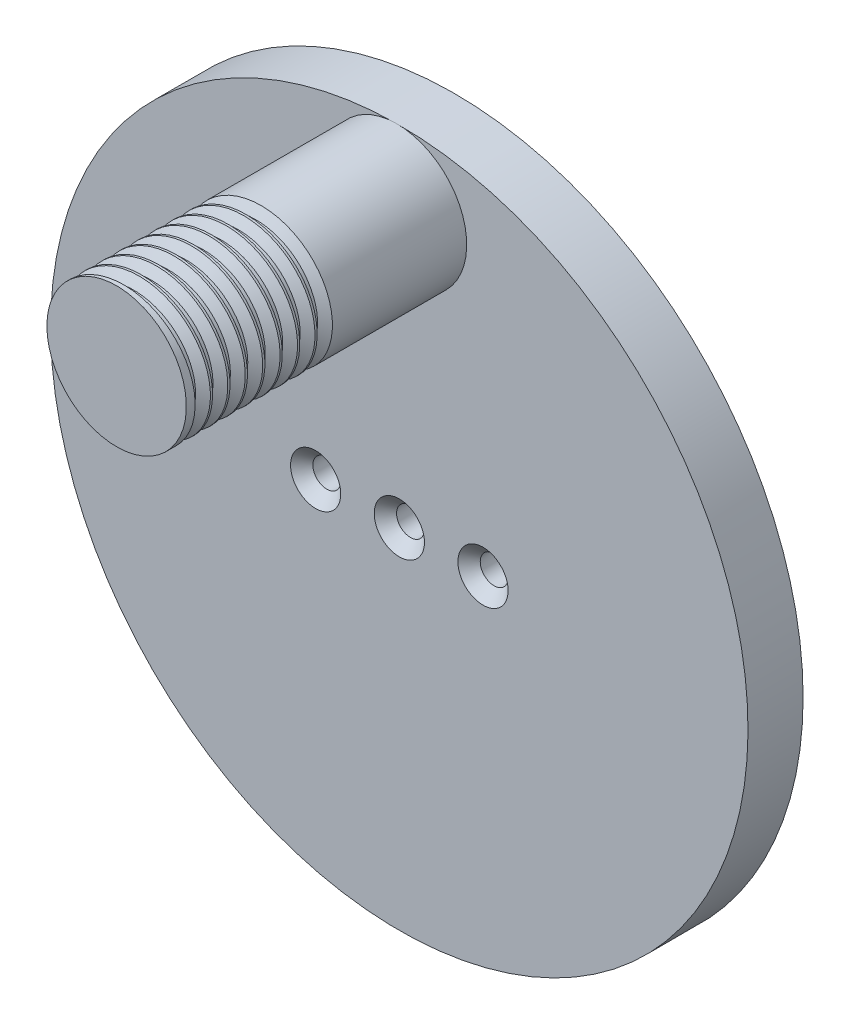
SolidWorks part; units mm, degrees
ref_plane "Front Plane" through (0, 0, 0) normal (0, 0, 1) x (1, 0, 0)
ref_plane "Top Plane" through (0, 0, 0) normal (0, 1, 0) x (1, 0, 0)
ref_plane "Right Plane" through (0, 0, 0) normal (1, 0, 0) x (0, 0, -1)
sketch "Sketch1" plane through (0, 0, 0) normal (0, 0, 1) x (1, 0, 0)
  line L0 (84.1798, -18.9431) -> (91.7726, -18.9431) construction
  line L1 (59.1798, 0) -> (109.1798, 0) construction
  line L6 (84.1798, -0.9431) -> (84.1798, -22.2144) construction
  line L11 (84.1798, -0.9431) -> (91.0108, -0.9431) construction
  circle A1 centre (84.1798, 0) radius 25
  dimension "D4" = 50
extrude "Boss-Extrude1" add sketch "Sketch1" along normal mid plane 3.95
sketch "Sketch15" plane through (0, 0, 1.975) normal (0, 0, 1) x (1, 0, 0)
  line L0 (59.1798, 0) -> (98.5992, 0) construction
  line L1 (84.1798, -25) -> (84.1798, 12.3053) construction
  circle A0 centre (84.1798, 0) radius 25 construction
  circle A1 centre (84.1798, 0) radius 0.5
  circle A2 centre (78.1798, 0) radius 0.5
  circle A3 centre (90.1798, 0) radius 0.5
  dimension "D1" = 1
  dimension "D2" = 12
extrude "Cut-Extrude1" cut sketch "Sketch15" against normal through all
hole_wizard "CSK for M1.6 Countersunk Flat Head Screw1" positions "Sketch33" profile "Sketch20" countersink size "M1.6" standard "ISO"
sketch "Sketch33" plane through (0, 0, 1.975) normal (0, 0, 1) x (1, 0, 0)
  point P7 (90.1798, 0)
  point P10 (84.1798, 0)
  point P13 (78.1798, 0)
sketch "Sketch20" plane through (90.1798, 0, 1.975) normal (1, 0, 0) x (0, -1, 0)
  line L0 (0, 0) -> (0, 3.95)
  line L1 (0, 3.95) -> (0.9, 3.95)
  line L2 (0.9, 3.95) -> (0.9, 0.9)
  line L3 (0.9, 0.9) -> (1.8, 0)
  line L5 (1.8, 0) -> (0, 0)
  line L6 (-0.9, 0.9) -> (-1.8, 0) construction
  line L11 (0, -6.35) -> (0, 107.95) construction
  dimension "Thru Hole Dia." = 1.8
  dimension "Thru Hole Depth" = 3.95
  dimension "Near C'Sink Dia." = 3.6
  dimension "Near C'Sink Angle" = 90
sketch "Sketch22" plane through (0, 0, 1.975) normal (0, 0, 1) x (1, 0, 0)
  line L0 (84.0102, -9.9431) -> (84.0102, 24.9994) construction
  circle A0 centre (84.1798, 0) radius 25 construction
  circle A1 centre (84.0102, 19.9993) radius 5
  dimension "D1" = 10
ref_plane "Plane1" through (0, 0, 4.975) normal (0, 0, 1) x (1, 0, 0)
sketch "Sketch30" plane through (0, 0, -1.975) normal (0, 0, -1) x (-1, 0, 0)
  circle A3 centre (-90.1798, 0) radius 1
  circle A4 centre (-84.1798, 0) radius 1
  circle A5 centre (-78.1798, 0) radius 1
  dimension "D2" = 2
extrude "Cut-Extrude2" cut sketch "Sketch30" against normal through all
extrude "Boss-Extrude2" add sketch "Sketch22" along normal blind 20.1
thread "Thread1" pitch 1.25 start angle 0, offset 0, length 10, pitch 1.25, diameter 10
ref_plane "Plane2" through (79.0102, 19.9993, 22.075) normal (0, -1, 0) x (-1, 0, 0)
sketch "Thread Profile1" plane through (79.0102, 19.9993, 22.075) normal (0, -1, 0) x (-1, 0, 0)
  line L0 (0, 0) -> (0, 1.25) construction
  line L11 (0, 0) -> (0, 1.0937)
  line L12 (0, 1.0937) -> (-0.6766, 0.7031)
  line L13 (-0.6766, 0.7031) -> (-0.6766, 0.3906)
  line L15 (-0.6766, 0.3906) -> (0, 0)
  line L17 (-0.6766, 0.5469) -> (0, 0.5469) construction
  point P2 (0, 0)
  dimension "Pitch" = 1.25
  dimension "Profile_Angle" = 60
  dimension "Profile_Land" = 0.3125
  dimension "Profile_Height" = 0.6766
equation "\"mm\"=0.8"
